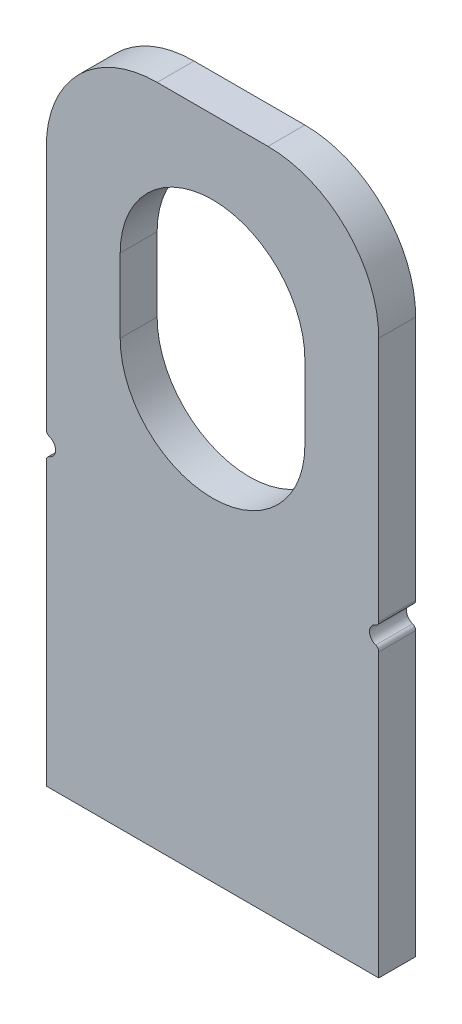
SolidWorks part; units mm, degrees
ref_plane "FRONT" through (0, 0, 0) normal (0, 0, 1) x (1, 0, 0)
ref_plane "TOP" through (0, 0, 0) normal (0, 1, 0) x (1, 0, 0)
ref_plane "RIGHT" through (0, 0, 0) normal (1, 0, 0) x (0, 0, -1)
sketch "Sketch1" plane through (0, 0, 0) normal (0, 0, 1) x (1, 0, 0)
  line L0 (31.75, 146.05) -> (31.75, 171.45)
  line L1 (57.15, 106.0901) -> (57.15, 190.5)
  line L2 (-31.75, 146.05) -> (-31.75, 171.45)
  line L3 (-57.15, 190.5) -> (-57.15, 106.0901)
  line L4 (-57.15, 0) -> (57.15, 0)
  line L5 (-57.15, 97.1099) -> (-57.15, 0)
  line L6 (57.15, 0) -> (57.15, 97.1099)
  line L7 (19.05, 228.6) -> (-19.05, 228.6)
  line L8 (0, -6.7056) -> (0, 178.2829) construction
  arc A0 (-31.75, 146.05) -> (31.75, 146.05) centre (0, 146.05) ccw
  arc A1 (-56.0917, 98.6066) -> (-56.0917, 104.5934) centre (-57.15, 101.6) ccw
  arc A2 (-56.0917, 98.6066) -> (-57.15, 97.1099) centre (-55.5625, 97.1099) ccw
  arc A3 (-57.15, 106.0901) -> (-56.0917, 104.5934) centre (-55.5625, 106.0901) ccw
  arc A4 (57.15, 97.1099) -> (56.0917, 98.6066) centre (55.5625, 97.1099) ccw
  arc A5 (56.0917, 104.5934) -> (57.15, 106.0901) centre (55.5625, 106.0901) ccw
  arc A6 (56.0917, 104.5934) -> (56.0917, 98.6066) centre (57.15, 101.6) ccw
  arc A7 (57.15, 190.5) -> (19.05, 228.6) centre (19.05, 190.5) ccw
  arc A8 (31.75, 171.45) -> (-31.75, 171.45) centre (0, 171.45) ccw
  arc A9 (-19.05, 228.6) -> (-57.15, 190.5) centre (-19.05, 190.5) ccw
  dimension "D4" = 25.4
  dimension "D5" = 31.75
  dimension "D6" = 38.1
  dimension "D8" = 3.175
  dimension "D9" = 1.5875
  dimension "D1" = 228.6
  dimension "D2" = 101.6
  dimension "D3" = 146.05
  dimension "D7" = 114.3
extrude "Extrude1" add sketch "Sketch1" along normal blind 12.7
